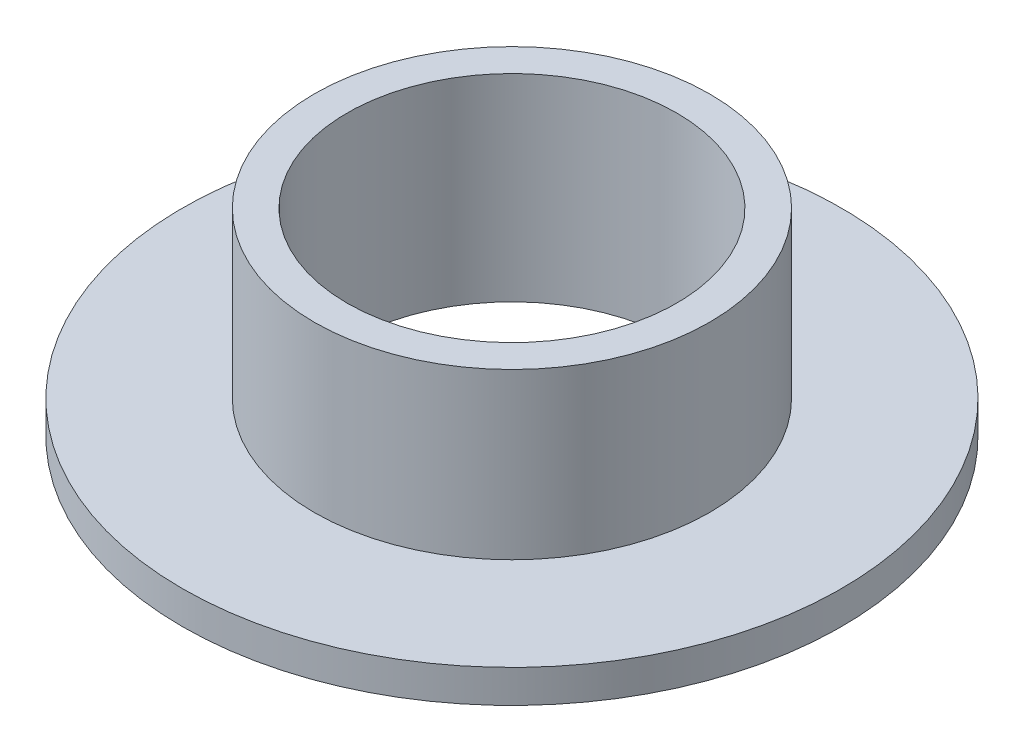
SolidWorks part; units mm, degrees
ref_plane "Front Plane" through (0, 0, 0) normal (0, 0, 1) x (1, 0, 0)
ref_plane "Top Plane" through (0, 0, 0) normal (0, 1, 0) x (1, 0, 0)
ref_plane "Right Plane" through (0, 0, 0) normal (1, 0, 0) x (0, 0, -1)
sketch "Sketch1" plane through (0, 0, 0) normal (0, 1, 0) x (1, 0, 0)
  circle A0 centre (0, 0) radius 25
  circle A1 centre (0, 0) radius 50
  dimension "D1" = 50
  dimension "D2" = 100
extrude "Boss-Extrude1" add sketch "Sketch1" along normal blind 5
sketch "Sketch2" plane through (0, 5, 0) normal (0, 1, 0) x (1, 0, 0)
  circle A0 centre (0, 0) radius 25
  circle A1 centre (0, 0) radius 30
  circle A2 centre (0, 0) radius 25 construction
  dimension "D1" = 5
extrude "Boss-Extrude2" add sketch "Sketch2" along normal blind 25
